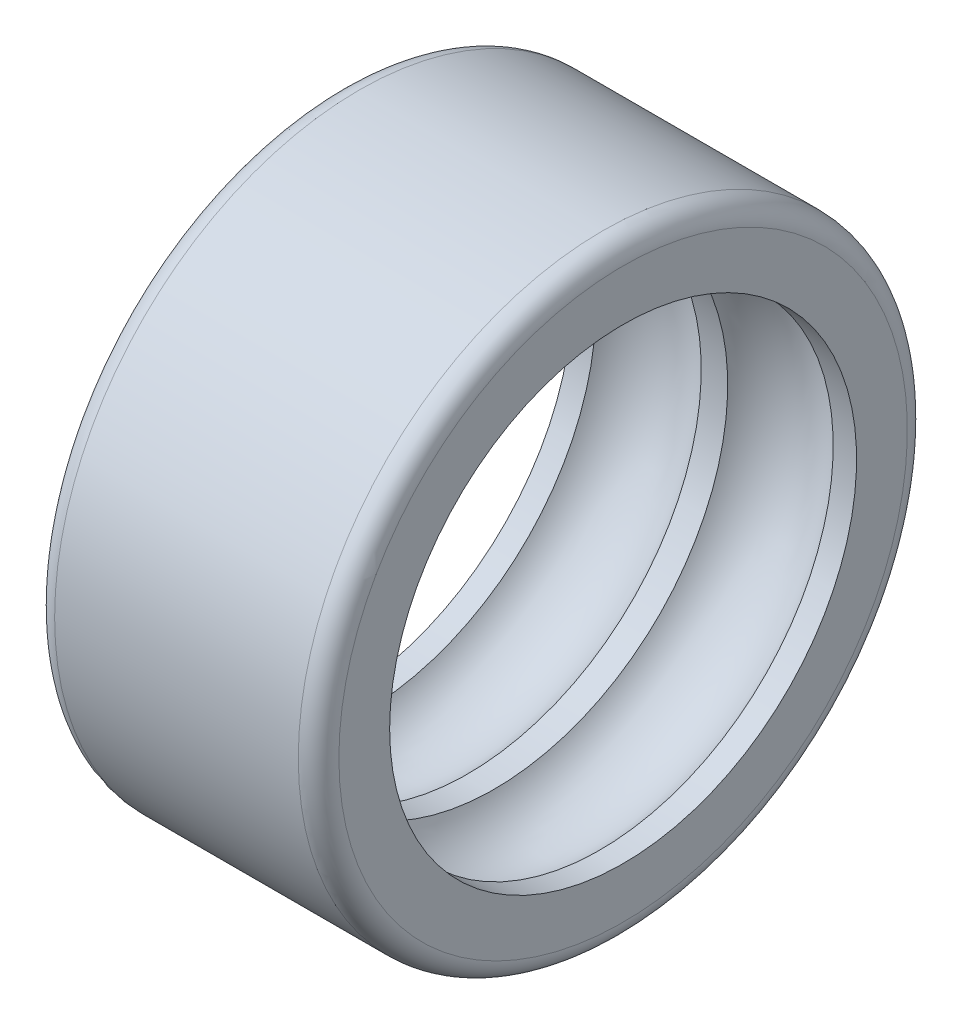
SolidWorks part; units mm, degrees
ref_plane "Plan1" through (0, 0, 0) normal (0, 0, 1) x (1, 0, 0)
ref_plane "Plan2" through (0, 0, 0) normal (0, 1, 0) x (1, 0, 0)
ref_plane "Plan3" through (0, 0, 0) normal (1, 0, 0) x (0, 0, -1)
sketch "Esquisse1" plane through (0, 0, 0) normal (0, 0, 1) x (1, 0, 0)
  line L0 (0, 11.5) -> (0, 15)
  line L1 (0, 15) -> (14, 15)
  line L2 (14, 15) -> (14, 11.5)
  line L3 (14, 11.5) -> (12.8481, 11.5)
  line L4 (13, 5) -> (1, 5) construction
  line L5 (0, 8.5) -> (0, -8.5) construction
  line L6 (7.6519, 11.5) -> (6.3481, 11.5)
  line L7 (1.1519, 11.5) -> (0, 11.5)
  line L8 (0, 0) -> (17.7699, 0) construction
  line L9 (0, 0) -> (30.1449, 0) construction
  arc A0 (6.3481, 11.5) -> (1.1519, 11.5) centre (3.75, 10) ccw
  arc A1 (12.8481, 11.5) -> (7.6519, 11.5) centre (10.25, 10) ccw
  arc A2 (7.6519, 8.5) -> (12.8481, 8.5) centre (10.25, 10) ccw construction
  arc A3 (1.1519, 8.5) -> (6.3481, 8.5) centre (3.75, 10) ccw construction
  dimension "D1" = 10
  dimension "D2" = 14
  dimension "D3" = 3.5
revolve "Base-Révolution" add sketch "Esquisse1" angle 360 about L8
fillet "Congé1" radius 1 2 edges at (0, 0, 15) (14, 0, 15)
sketch "Esquisse2" [suppressed] plane through (0, 0, 0) normal (0, 1, 0) x (1, 0, 0)
  point P7 (7, 0)
sketch "Esq_WRNL_Compact001" plane through (0, 0, 0) normal (0, 0, 1) x (1, 0, 0)
  line L0 (-1, -16) -> (-1, 16)
  line L1 (15, -16) -> (15, 16)
  line L2 (-1, -16) -> (15, -16)
  line L3 (-1, 16) -> (15, 16)
